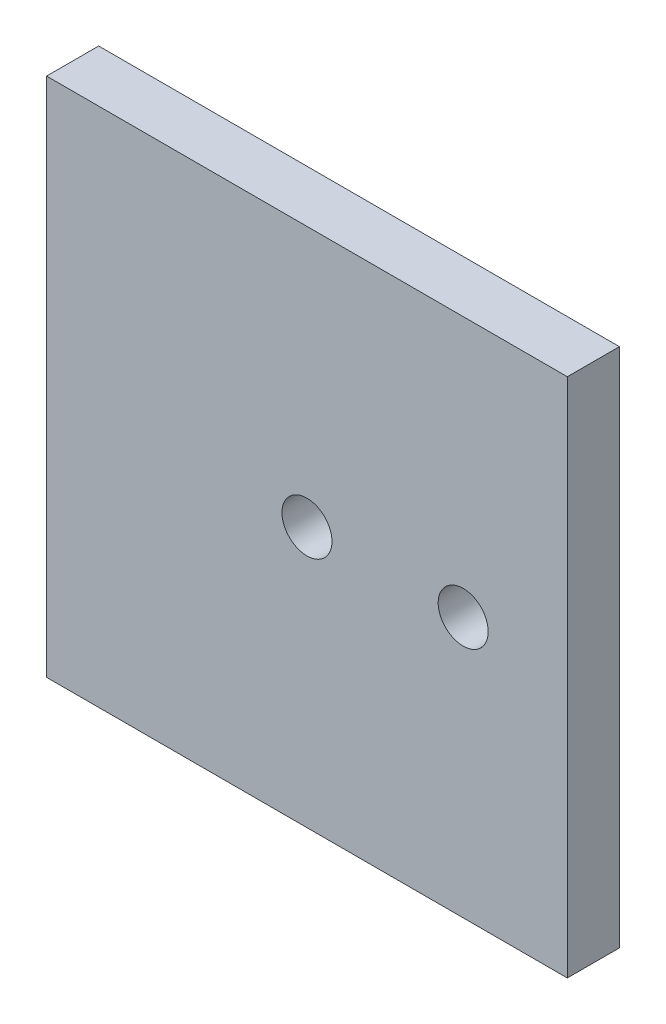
SolidWorks part; units mm, degrees
ref_plane "Front Plane" through (0, 0, 0) normal (0, 0, 1) x (1, 0, 0)
ref_plane "Top Plane" through (0, 0, 0) normal (0, 1, 0) x (1, 0, 0)
ref_plane "Right Plane" through (0, 0, 0) normal (1, 0, 0) x (0, 0, -1)
sketch "Sketch1" plane through (0, 0, 0) normal (0, 0, 1) x (1, 0, 0)
  line L1 (0, 0) -> (127, 0)
  line L2 (0, 0) -> (0, 127)
  line L3 (0, 127) -> (127, 127)
  line L4 (127, 0) -> (127, 127)
  dimension "D1" = 127
  dimension "D2" = 127
extrude "Extrude1" add sketch "Sketch1" along normal blind 12.7
sketch "Sketch2" plane through (0, 0, 12.7) normal (0, 0, 1) x (1, 0, 0)
  line L0 (0, 63.5) -> (127, 63.5) construction
  line L1 (0, 127) -> (0, 0) construction
  line L2 (127, 0) -> (127, 127) construction
  circle A0 centre (101.6, 63.5) radius 6.1
  dimension "D1" = 12.2
  dimension "D2" = 25.4
extrude "Cut-Extrude1" cut sketch "Sketch2" against normal through all
sketch "Sketch3" plane through (-27.7873, -2.7761, 12.7) normal (0, 0, 1) x (1, 0, 0)
  line L0 (27.7873, 66.2761) -> (156.0817, 66.2761) construction
  line L3 (27.7873, 129.7761) -> (27.7873, 2.7761) construction
  circle A0 centre (91.2873, 66.2761) radius 6.1
  circle A1 centre (129.3873, 66.2761) radius 6.1 construction
  dimension "D1" = 12.2
  dimension "D2" = 38.1
extrude "Cut-Extrude2" cut sketch "Sketch3" against normal through all
